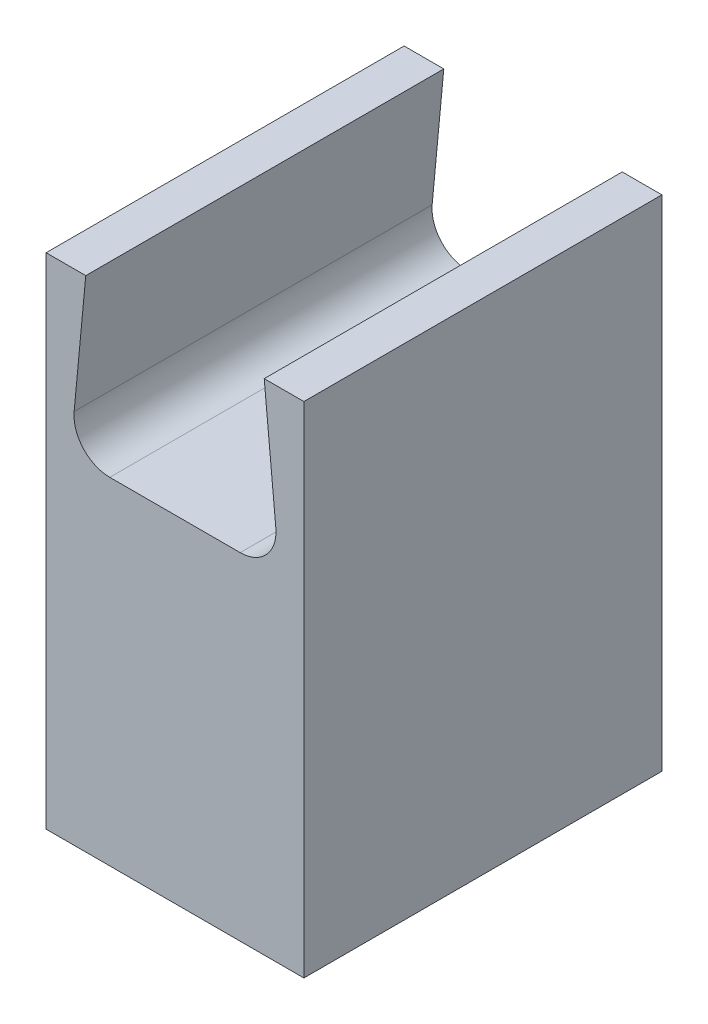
SolidWorks part; units mm, degrees
ref_plane "Alzado" through (0, 0, 0) normal (0, 0, 1) x (1, 0, 0)
ref_plane "Planta" through (0, 0, 0) normal (0, 1, 0) x (1, 0, 0)
ref_plane "Vista lateral" through (0, 0, 0) normal (1, 0, 0) x (0, 0, -1)
sketch "Croquis1" plane through (0, 0, 0) normal (0, 0, 1) x (1, 0, 0)
  line L0 (-9, 4.26) -> (-9, -30.6)
  line L1 (-9, -30.6) -> (9, -30.6)
  line L2 (0, -7.1) -> (0, -30.6) construction
  line L10 (9, -30.6) -> (9, 4.26)
  line L11 (9, 4.26) -> (6.23, 4.26)
  line L12 (6.23, 4.26) -> (7.3, -7.1)
  line L13 (7.3, -7.1) -> (-7.3, -7.1)
  line L14 (-7.3, -7.1) -> (-6.23, 4.26)
  line L15 (-6.23, 4.26) -> (-9, 4.26)
  line L18 (-6.23, 4.26) -> (6.23, 4.26) construction
  line L19 (0, 4.26) -> (0, -7.1) construction
extrude "Saliente-Extruir1" add sketch "Croquis1" along normal blind 25
sketch "Croquis2" plane through (0, -30.6, 0) normal (0, -1, 0) x (1, 0, 0)
  line L0 (-9, 25) -> (-9, 30)
  line L1 (-9, 30) -> (9, 30)
  line L2 (9, 30) -> (9, 25)
  line L3 (-9, 25) -> (9, 25) construction
  line L4 (-9, 36.4318) -> (-9, 43)
  line L5 (-9, 43) -> (9, 43)
  line L6 (9, 43) -> (9, 36.4318)
  line L7 (-9, 25) -> (9, 25)
  line L8 (0, 25) -> (0, 0) construction
  circle A0 centre (0, 130) radius 100
  circle A1 centre (0, 130) radius 94
  dimension "D2" = 200
  dimension "D1" = 5
  dimension "D4" = 18
  dimension "D5" = 18
  dimension "D3" = 6
fillet "Redondeo1" radius 2.5 2 edges at (-7.3, -7.1, 12.5) (7.3, -7.1, 12.5)
equation "\"D9@Croquis1\"= \"D8@Croquis1\""
